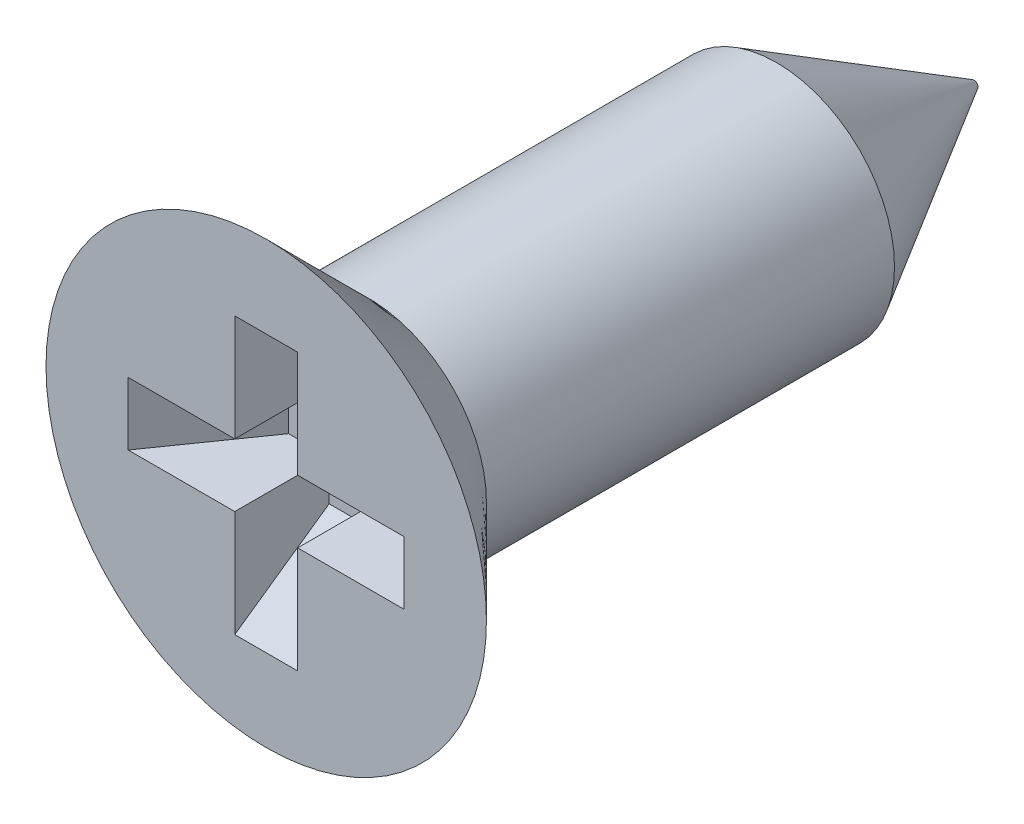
SolidWorks part; units mm, degrees
ref_plane "Plan de face" through (0, 0, 0) normal (0, 0, 1) x (1, 0, 0)
ref_plane "Plan de dessus" through (0, 0, 0) normal (0, 1, 0) x (1, 0, 0)
ref_plane "Plan de droite" through (0, 0, 0) normal (1, 0, 0) x (0, 0, -1)
sketch "Esquisse1" plane through (0, 0, 0) normal (1, 0, 0) x (0, 0, -1)
  line L0 (-1.6035, 0) -> (7.1529, 0) construction
  line L1 (0, 5.0438) -> (0, -4.594) construction
  line L2 (0, 2.8) -> (1.3, 1.5)
  line L3 (1.3, 1.5) -> (1.3, 0)
  line L4 (-1.442, 2.8) -> (2.7621, 2.8) construction
  line L5 (0, 2.8) -> (8.0274, -5.2274) construction
  line L6 (-1.0988, 1.5) -> (4.1029, 1.5) construction
  line L7 (1.3, 0) -> (0, 0)
  line L9 (0, 2.8) -> (0, 0)
revolve "Révolution2" add sketch "Esquisse1" angle 360 about L0
sketch "Esquisse3" plane through (0, 0, 0) normal (0, 0, 1) x (1, 0, 0)
  circle A0 centre (0, 0) radius 1.5
extrude "Extrusion1" add sketch "Esquisse3" against normal blind 9
sketch "Esquisse2" plane through (0, 0, 0) normal (0, 0, 1) x (1, 0, 0)
  line L0 (0.4, -0.4) -> (1.755, -0.4)
  line L1 (0.4, 0.4) -> (1.755, 0.4)
  line L2 (-1.755, -0.4) -> (-0.4, -0.4)
  line L3 (-0.4, 1.755) -> (-0.4, 0.4)
  line L4 (-1.755, 0.4) -> (-0.4, 0.4)
  line L5 (0.4, 1.755) -> (0.4, 0.4)
  line L6 (-0.4, 1.755) -> (0.4, 1.755)
  line L7 (1.755, 0.4) -> (1.755, -0.4)
  line L8 (0.4, -1.755) -> (-0.4, -1.755)
  line L9 (-1.755, -0.4) -> (-1.755, 0.4)
  line L10 (-0.4, -0.4) -> (-0.4, -1.755)
  line L12 (0.4, -0.4) -> (0.4, -1.755)
  circle A0 centre (0, 0) radius 1.8 construction
extrude "Enlèv. mat.-Extru.2" cut sketch "Esquisse2" against normal blind 1.2
draft "Dépouille3" type of draft neutral plane draft angle 35 faces to draft 4 parameters "D1"=35
chamfer "Chanfrein1" distance 1.45 angle 60 1 edges at (1.5, 0, -9)
